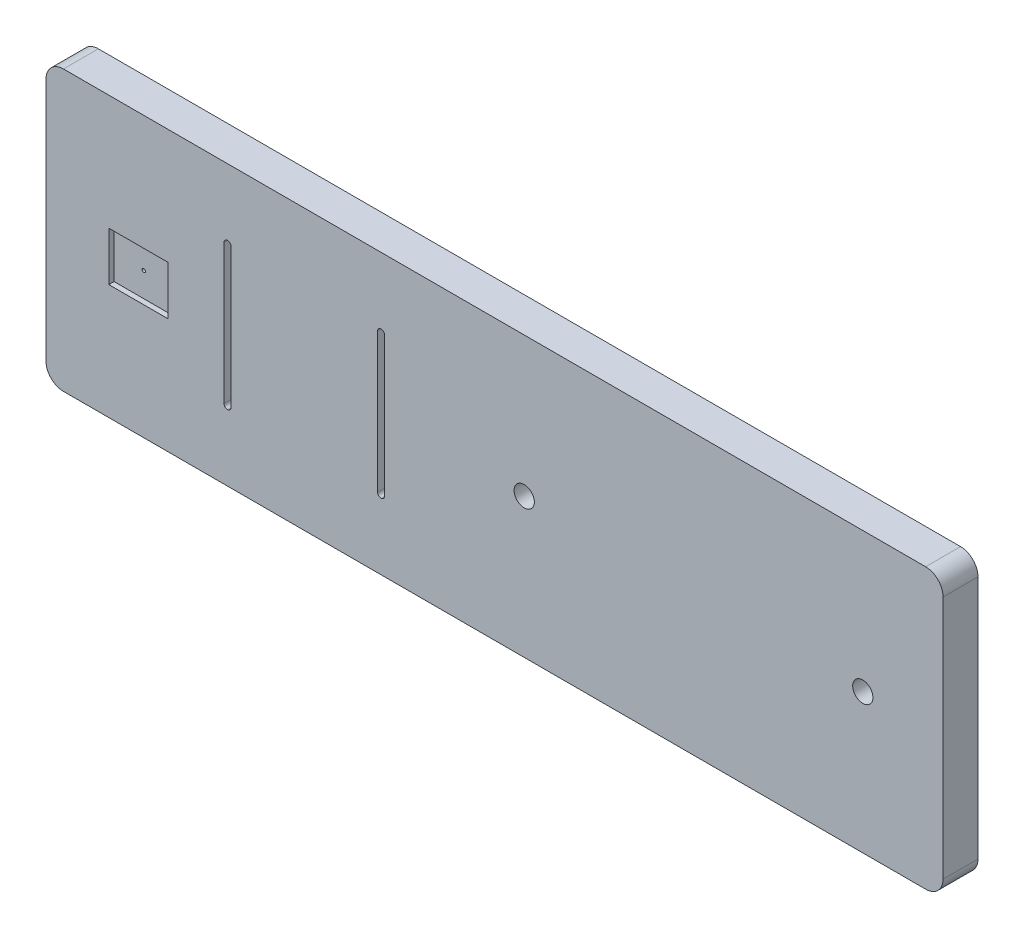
SolidWorks part; units mm, degrees
ref_plane "Plan de face" through (0, 0, 0) normal (0, 0, 1) x (1, 0, 0)
ref_plane "Plan de dessus" through (0, 0, 0) normal (0, 1, 0) x (1, 0, 0)
ref_plane "Plan de droite" through (0, 0, 0) normal (1, 0, 0) x (0, 0, -1)
sketch "Esquisse1" plane through (0, 0, 0) normal (0, 0, 1) x (1, 0, 0)
  line L0 (-199.323, 0) -> (110.8007, 0) construction
  line L1 (97, 6.9729) -> (97, -11.5721) construction
  line L2 (-205.0606, 40) -> (160.4354, 40) construction
  line L3 (-207.2404, -40) -> (167.4995, -40) construction
  line L4 (120, 52.1937) -> (120, -69.662) construction
  line L5 (-137, 52.1937) -> (-137, -57.199) construction
  line L7 (115, 40) -> (-132, 40)
  line L8 (120, 35) -> (120, -35)
  line L9 (115, -40) -> (-132, -40)
  line L10 (-137, 35) -> (-137, -35)
  circle A0 centre (97, 0) radius 2.9
  circle A1 centre (0, 0) radius 2.9
  arc A2 (-132, 40) -> (-137, 35) centre (-132, 35) ccw
  arc A3 (115, 40) -> (120, 35) centre (115, 35) cw
  arc A4 (120, -35) -> (115, -40) centre (115, -35) cw
  arc A5 (-132, -40) -> (-137, -35) centre (-132, -35) cw
  point P25 (120, 40)
  point P30 (-137, -40)
  dimension "D1" = 5
  dimension "D2" = 137
extrude "Extrusion1" add sketch "Esquisse1" along normal blind 10
sketch "Esquisse2" plane through (0, 0, 10) normal (0, 0, 1) x (1, 0, 0)
  line L0 (-36, 49.474) -> (-36, -49.474) construction
  line L1 (-40, 43.9765) -> (-40, -45.1875) construction
  line L2 (-42, 40.0998) -> (-42, -43.1568) construction
  line L3 (-84, 40.0998) -> (-84, -47.0335) construction
  line L4 (-86, 40.0998) -> (-86, -47.0335) construction
  line L5 (-100.7259, 20.99) -> (-41.5985, 20.99) construction
  line L6 (-137, 35) -> (-137, -35) construction
  line L7 (-85.01, 20.99) -> (-84.99, 20.99)
  line L8 (-86, 20) -> (-86, -20)
  line L9 (-85.01, -20.99) -> (-84.99, -20.99)
  line L10 (-84, 20) -> (-84, -20)
  line L11 (-41.01, 20.99) -> (-40.99, 20.99)
  line L12 (-42, 20) -> (-42, -20)
  line L13 (-41.01, -20.99) -> (-40.99, -20.99)
  line L14 (-88.8674, -19) -> (-27.1692, -19) construction
  line L15 (-42, 47.484) -> (-42, -63.5395) construction
  line L16 (-84, 55.7715) -> (-84, -59.6276) construction
  line L17 (-86, 55.7715) -> (-86, -67.2735) construction
  line L18 (-40, 20) -> (-40, -20)
  arc A0 (-85.01, 20.99) -> (-86, 20) centre (-85.01, 20) ccw
  arc A1 (-84.99, 20.99) -> (-84, 20) centre (-84.99, 20) cw
  arc A2 (-86, -20) -> (-85.01, -20.99) centre (-85.01, -20) ccw
  arc A3 (-84.99, -20.99) -> (-84, -20) centre (-84.99, -20) ccw
  arc A4 (-41.01, 20.99) -> (-42, 20) centre (-41.01, 20) ccw
  arc A5 (-40.99, 20.99) -> (-40, 20) centre (-40.99, 20) cw
  arc A6 (-40.99, -20.99) -> (-40, -20) centre (-40.99, -20) ccw
  arc A7 (-42, -20) -> (-41.01, -20.99) centre (-41.01, -20) ccw
  point P30 (-86, 20.99)
  point P37 (-84, -20.99)
  point P40 (-42, 20.99)
  point P45 (-40, -20.99)
  dimension "D1" = 0.99
  dimension "D2" = 46
  dimension "D3" = 42
  dimension "D4" = 40
  dimension "D5" = 20
  dimension "D6" = 20
  dimension "D7" = 51
  dimension "D8" = 53
extrude "Enlèv. mat.-Extru.1" cut sketch "Esquisse2" against normal blind 5
sketch "Esquisse4" plane through (0, 0, 10) normal (0, 0, 1) x (1, 0, 0)
  line L0 (-69, 27.3178) -> (-69, -33.4743) construction
  line L1 (-102, 27.3178) -> (-102, -31.9475) construction
  line L2 (-119, 25.5134) -> (-119, -29.1716) construction
  line L3 (-124.1438, 7) -> (-98.4668, 7) construction
  line L4 (-122.8946, -7) -> (-95.2745, -7) construction
  line L5 (-93.5, 2.8899) -> (-93.5, -3.4946) construction
  line L6 (-119, 7) -> (-102, 7)
  line L7 (-119, 7) -> (-119, -7)
  line L8 (-119, -7) -> (-102, -7)
  line L9 (-102, 7) -> (-102, -7)
  line L10 (-105.8946, -0.3024) -> (-87.9901, -0.3024) construction
  line L11 (-137, 35) -> (-137, -35) construction
  dimension "D1" = 18
extrude "Enlèv. mat.-Extru.2" cut sketch "Esquisse4" against normal blind 1.5
sketch "Esquisse5" plane through (0, 0, 8.5) normal (0, 0, 1) x (1, 0, 0)
  circle A0 centre (-110.5, 0) radius 0.5
extrude "Enlèv. mat.-Extru.3" cut sketch "Esquisse5" against normal blind 2
